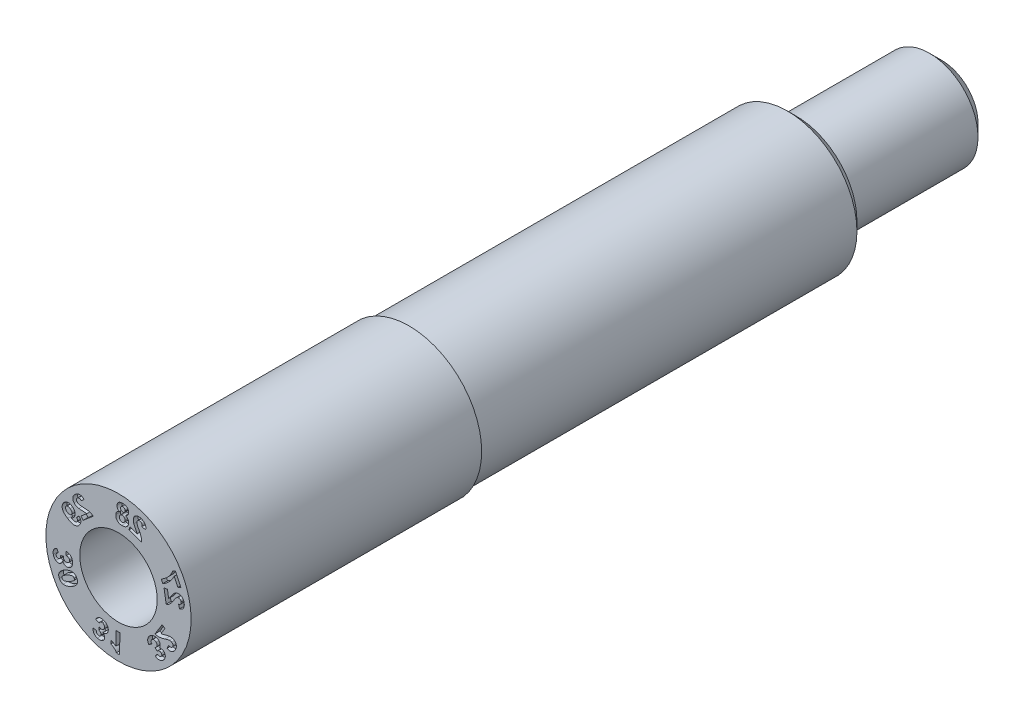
SolidWorks part; units mm, degrees
other "<M2 X .4 SHSS>-<Revolve1>"
ref_plane "Front Plane" through (0, 0, 0) normal (0, 0, 1) x (1, 0, 0)
ref_plane "Top Plane" through (0, 0, 0) normal (0, 1, 0) x (1, 0, 0)
ref_plane "Right Plane" through (0, 0, 0) normal (1, 0, 0) x (0, 0, -1)
sketch "Sketch1" plane through (0, 0, 0) normal (1, 0, 0) x (0, 0, -1)
  line L2 (0, 1.5) -> (0, 0.8)
  line L3 (13.75, 1.5) -> (0, 1.5)
  line L4 (-3.7979, 0) -> (49996.2021, 0) construction
  line L8 (11, 0.6) -> (2.2, 0.6)
  line L9 (2.2, 0.8) -> (2.2, 0.6)
  line L10 (2.2, 0.8) -> (0, 0.8)
  line L12 (14, 1) -> (14, 1.25)
  line L16 (14, 1.25) -> (13.75, 1.5)
  line L17 (14, 1) -> (11, 1)
  line L18 (11, 0.6) -> (11, 1)
  dimension "D1" = 14
  dimension "D2" = 45
  dimension "D3" = 0.25
  dimension "D4" = 3
  dimension "D5" = 1.6
  dimension "D6" = 2.2
  dimension "D7" = 1.2
  dimension "D8" = 2
  dimension "D9" = 3
revolve "Revolve1" add sketch "Sketch1" angle 360 about L4
sketch "Sketch5" plane through (0, 0, 0) normal (1, 0, 0) x (0, 0, -1)
  line L0 (0, 0) -> (50000, 0) construction
  line L1 (0, 1.5) -> (0, -1.5) construction
  line L2 (6, 1.435) -> (14, 1.435)
  line L3 (6, 1.435) -> (6, 2.435)
  line L4 (6, 2.435) -> (14, 2.435)
  line L5 (14, 1.435) -> (14, 2.435)
  line L6 (14, -1.25) -> (14, 1.25) construction
  line L7 (13.75, 1.5) -> (0, 1.5) construction
  dimension "D1" = 6
  dimension "D2" = 0.065
  dimension "D3" = 1
revolve "Cut-Revolve1" cut sketch "Sketch5" angle 360 about L0
sketch "Sketch2" plane through (0, 0, 0) normal (0, 0, 1) x (1, 0, 0)
  line L0 (0, 0) -> (0, 2.3112) construction
  line L1 (0, 0) -> (2.0015, 1.1556) construction
  line L2 (0, 0) -> (2.0015, -1.1556) construction
  line L3 (0, 0) -> (0, -2.3112) construction
  line L4 (0, 0) -> (-2.0015, -1.1556) construction
  line L5 (0, 0) -> (-2.0015, 1.1556) construction
  circle A0 centre (0, 0) radius 0.9867 construction
  text T0 "27    28    29    30    31    32" font "Arial" height 0.4
  point P10 (0, 0)
  point P746 (4, 0.001)
  point P747 (0.0034, 0.0034)
  point P748 (0.0034, 0)
  dimension "D1" = 6
extrude "Cut-Extrude1" cut sketch "Sketch2" against normal blind 0.1
sketch "Sketch3" plane through (0, 0, -2.2) normal (0, 0, 1) x (1, 0, 0)
  line L0 (0, 0) -> (0, 50000) construction
  line L1 (0.3464, 0.6) -> (-0.3464, 0.6)
  line L2 (-0.3464, 0.6) -> (-0.6928, 0)
  line L3 (-0.6928, 0) -> (-0.3464, -0.6)
  line L4 (-0.3464, -0.6) -> (0.3464, -0.6)
  line L5 (0.3464, -0.6) -> (0.6928, 0)
  line L6 (0.6928, 0) -> (0.3464, 0.6)
  line L7 (0, 0) -> (50000, 0) construction
  circle A0 centre (0, 0) radius 0.6 construction
  circle A1 centre (0, 0) radius 0.6 construction
extrude "Cut-Extrude2" cut sketch "Sketch3" against normal blind 1.4
inserted part "M2 X .4 SHSS"
move or copy body "Body-Move/Copy2" placed by mates yes
